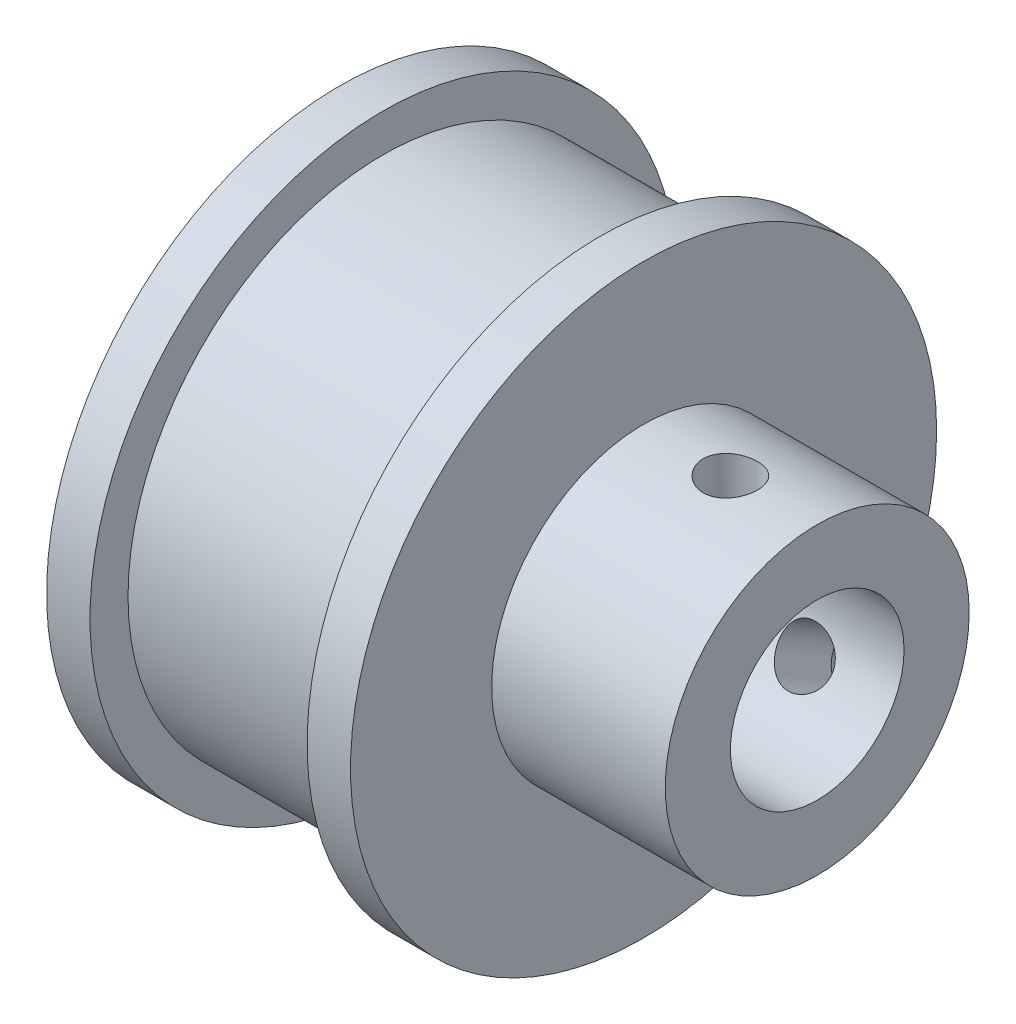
SolidWorks part; units mm, degrees
ref_plane "正面" through (0, 0, 0) normal (0, 0, 1) x (1, 0, 0)
ref_plane "平面" through (0, 0, 0) normal (0, 1, 0) x (1, 0, 0)
ref_plane "右側面" through (0, 0, 0) normal (1, 0, 0) x (0, 0, -1)
sketch "ｽｹｯﾁ1" plane through (0, 0, 0) normal (1, 0, 0) x (0, 0, -1)
  circle A0 centre (0, 0) radius 13.5
  dimension "D1" = 27
extrude "押し出し1" add sketch "ｽｹｯﾁ1" along normal blind 22
ref_plane "平面1" through (2, 0, 0) normal (1, 0, 0) x (0, 0, -1)
sketch "ｽｹｯﾁ2" plane through (2, 0, 0) normal (1, 0, 0) x (0, 0, -1)
  circle A0 centre (0, 0) radius 11.75
  dimension "D1" = 23.5
extrude "ｶｯﾄ - 押し出し1" cut sketch "ｽｹｯﾁ2" along normal blind 10 flip side to cut
sketch "ｽｹｯﾁ3" plane through (22, 0, 0) normal (1, 0, 0) x (0, 0, -1)
  circle A0 centre (0, 0) radius 7
  dimension "D1" = 14
extrude "ｶｯﾄ - 押し出し2" cut sketch "ｽｹｯﾁ3" against normal blind 8 flip side to cut
sketch "ｽｹｯﾁ4" plane through (22, 0, 0) normal (1, 0, 0) x (0, 0, -1)
  circle A0 centre (0, 0) radius 4
  dimension "D1" = 8
extrude "ｶｯﾄ - 押し出し3" cut sketch "ｽｹｯﾁ4" against normal through all
sketch "ｽｹｯﾁ5" plane through (0, 0, 0) normal (0, 1, 0) x (1, 0, 0)
  line L0 (22, 0) -> (18, 0) construction
  line L1 (22, -7) -> (22, 7) construction
  circle A0 centre (18, 0) radius 1.25
  dimension "D1" = 2.5
  dimension "D2" = 4
extrude "ｶｯﾄ - 押し出し4" cut sketch "ｽｹｯﾁ5" along normal through all
pattern_circular "円形ﾊﾟﾀｰﾝ1" count 2 every 120 about axis through (14, 0, 0) along (1, 0, 0) of "ｶｯﾄ - 押し出し4"
